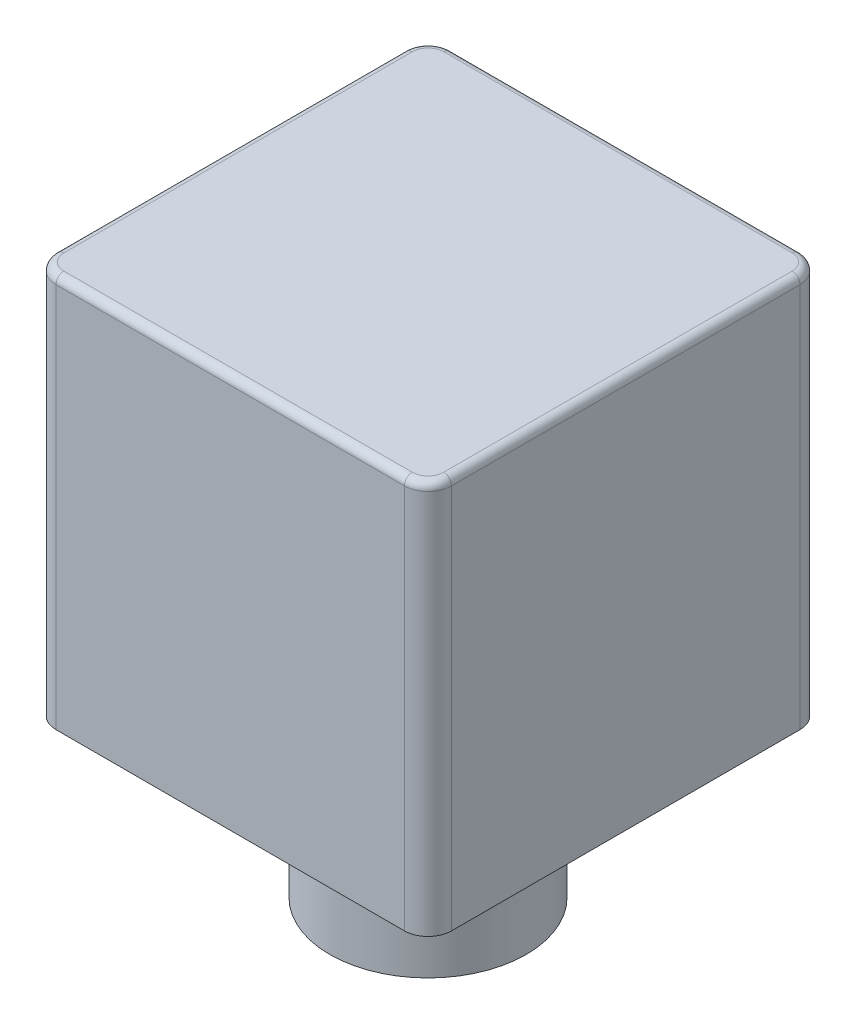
SolidWorks part; units mm, degrees
ref_plane "Front" through (0, 0, 0) normal (0, 0, 1) x (1, 0, 0)
ref_plane "Top" through (0, 0, 0) normal (0, 1, 0) x (1, 0, 0)
ref_plane "Right" through (0, 0, 0) normal (1, 0, 0) x (0, 0, -1)
sketch "Sketch1" plane through (0, 0, 0) normal (0, 1, 0) x (1, 0, 0)
  line L0 (4.5, 6) -> (4.5, -6)
  arc A0 (4.5, 6) -> (4.5, -6) centre (0, 0) ccw
  circle A1 centre (0, 0) radius 12.5
  dimension "D1" = 15
  dimension "D2" = 25
  dimension "D3" = 12
extrude "Extrude1" add sketch "Sketch1" along normal blind 20
sketch "Sketch2" plane through (0, 20, 0) normal (0, 1, 0) x (-1, 0, 0)
  line L0 (-25.1478, 25.1478) -> (25.1478, -25.1478) construction
  line L1 (-25.1478, -25.1478) -> (25.1478, -25.1478)
  line L2 (-25.1478, -25.1478) -> (-25.1478, 25.1478)
  line L3 (-25.1478, 25.1478) -> (25.1478, 25.1478)
  line L4 (25.1478, -25.1478) -> (25.1478, 25.1478)
extrude "Extrude2" add sketch "Sketch2" along normal blind 50
fillet "Fillet1" radius 3 5 edges at (25.1478, 45, 25.1478) (25.1478, 45, -25.1478) (-25.1478, 45, -25.1478) (-25.1478, 45, 25.1478) (0, 20, 12.5)
fillet "Fillet3" radius 1 8 edges at (0, 70, 25.1478) (-25.1478, 70, 0) (25.1478, 70, 0) (0, 70, -25.1478) (24.2691, 70, -24.2691) (24.2691, 70, 24.2691) (-24.2691, 70, -24.2691) (-24.2691, 70, 24.2691)
